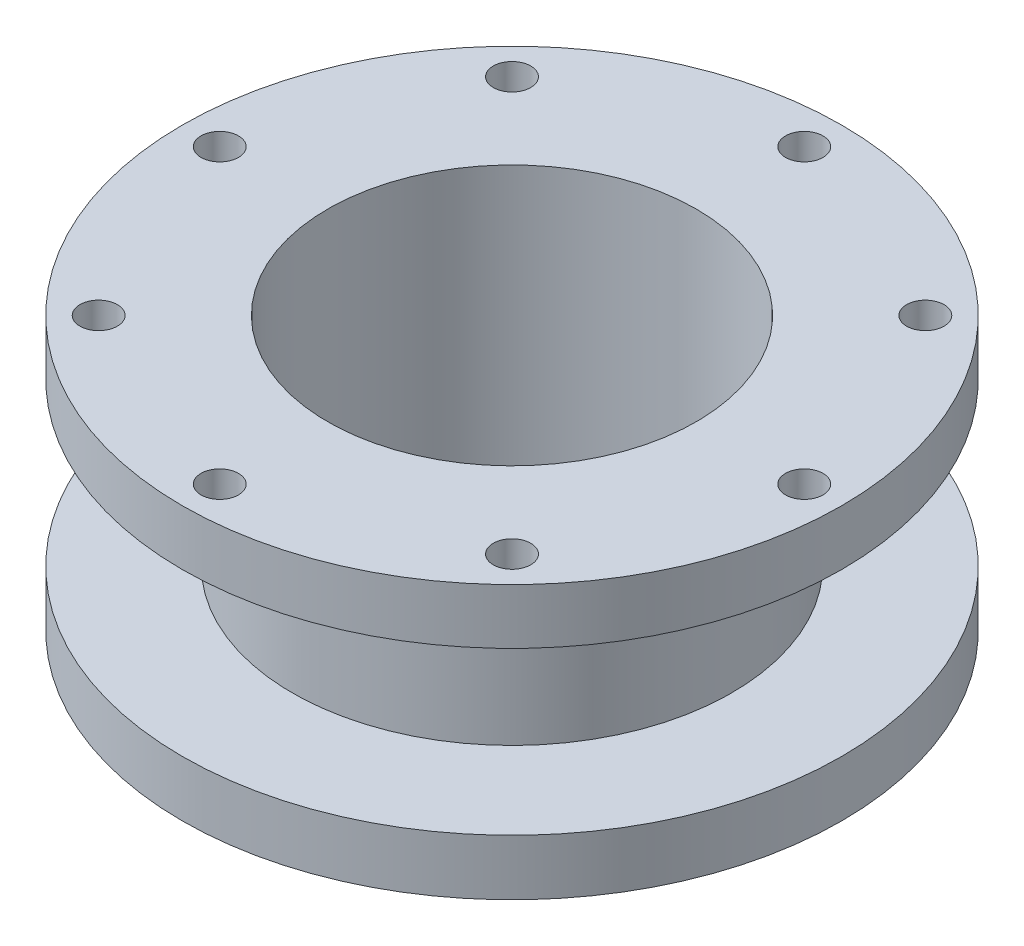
SolidWorks part; units mm, degrees
ref_plane "Plan1" through (0, 0, 0) normal (0, 0, 1) x (1, 0, 0)
ref_plane "Plan2" through (0, 0, 0) normal (0, 1, 0) x (1, 0, 0)
ref_plane "Plan3" through (0, 0, 0) normal (1, 0, 0) x (0, 0, -1)
sketch "Esquisse1" plane through (0, 0, 0) normal (0, 0, 1) x (1, 0, 0)
  line L0 (0, 0) -> (0, 79.8493) construction
  line L1 (-32, 12.6) -> (-32, 60)
  line L2 (-32, 60) -> (-57.25, 60)
  line L3 (-57.25, 60) -> (-57.25, 50.4)
  line L4 (-57.25, 50.4) -> (-38.15, 50.4)
  line L5 (-38.15, 50.4) -> (-38.15, 22.3)
  line L6 (-38.15, 22.3) -> (-57.25, 22.3)
  line L7 (-57.25, 22.3) -> (-57.25, 12.6)
  line L8 (-57.25, 12.6) -> (-32, 12.6)
  line L9 (50, 0) -> (-50, 0) construction
  dimension "D1" = 12.6
  dimension "D2" = 22.3
  dimension "D3" = 50.4
  dimension "D4" = 60
  dimension "D5" = 64
  dimension "D6" = 76.3
  dimension "D7" = 114.5
revolve "Révolution1" add sketch "Esquisse1" angle 360 about L0
hole_wizard "Diamètre du perçage Ø6.5 (6.5)1" positions "Esquisse3" profile "Esquisse2" hole size "Ø6.5" standard "ISO"
sketch "Esquisse3" plane through (0, 60, 0) normal (0, 1, 0) x (-1, 0, 0)
  circle A0 centre (0, 0) radius 50.75
  point P0 (0, 50.75)
  dimension "D1" = 101.5
sketch "Esquisse2" plane through (0, 60, 50.75) normal (1, 0, 0) x (0, 0, 1)
  line L0 (0, 0) -> (0, 21.9528)
  line L1 (0, 21.9528) -> (3.25, 20)
  line L2 (3.25, 20) -> (3.25, 0)
  line L5 (3.25, 0) -> (0, 0)
  line L10 (0, 21.9528) -> (-3.25, 20) construction
  line L11 (0, -6.35) -> (0, 107.95) construction
  dimension "Diamètre du perçage" = 6.5
  dimension "Profondeur du perçage" = 20
  dimension "Angle de pointe" = 118
pattern_circular "Répétition circulaire1" count 8 over 360 about axis through (0, 0, 0) along (0, 1, 0) of "Diamètre du perçage Ø6.5 (6.5)1"
